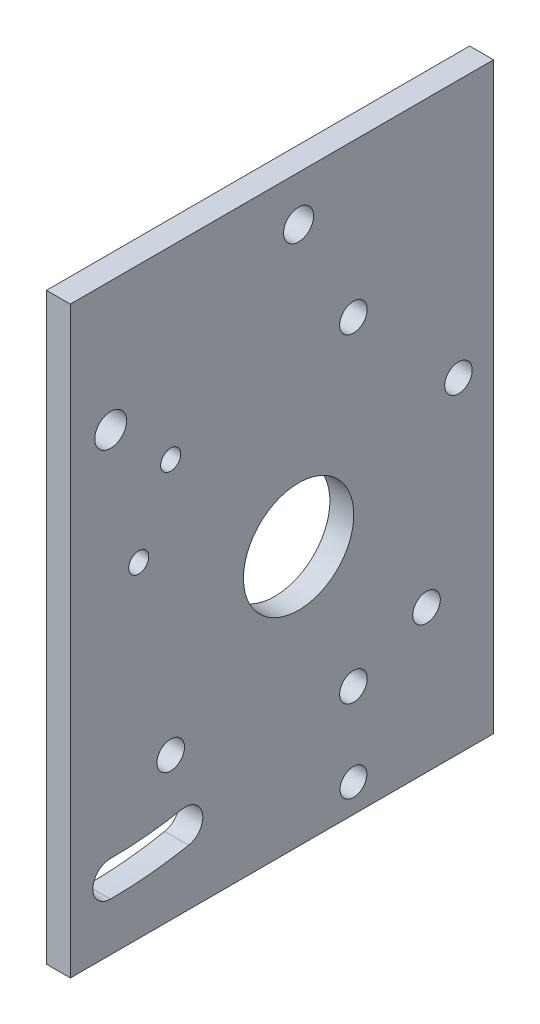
SolidWorks part; units mm, degrees
ref_plane "Front Plane" through (0, 0, 0) normal (0, 0, 1) x (1, 0, 0)
ref_plane "Top Plane" through (0, 0, 0) normal (0, 1, 0) x (1, 0, 0)
ref_plane "Right Plane" through (0, 0, 0) normal (1, 0, 0) x (0, 0, -1)
sketch "Sketch1" plane through (0, 0, 0) normal (1, 0, 0) x (0, 0, -1)
  line L0 (0, 0) -> (-56.4054, 0) construction
  line L1 (38.8644, 64.6163) -> (-45.507, 64.6163)
  line L2 (38.8644, 64.6163) -> (38.8644, -51.7436)
  line L3 (38.8644, -51.7436) -> (-45.507, -51.7436)
  line L4 (-45.507, 64.6163) -> (-45.507, -51.7436)
  line L5 (38.8644, 64.6163) -> (-45.507, -51.7436) construction
  line L6 (38.8644, -51.7436) -> (-45.507, 64.6163) construction
  line L7 (0, 0) -> (0, 42.8926) construction
  circle A0 centre (0, 0) radius 11
  circle A1 centre (-25.5, 27.7621) radius 2
  circle A2 centre (10.9377, 34.1371) radius 2.75
  circle A3 centre (10.9377, -29.6129) radius 2.75
  arc A4 (-37.5233, -38.6139) -> (-22.5927, -37.1728) centre (-37.4682, 38.8861) ccw construction
  arc A5 (-37.5258, -42.1139) -> (-21.9209, -40.6078) centre (-37.4682, 38.8861) ccw
  circle A6 centre (25.5, -23.2379) radius 2.75
  circle A7 centre (31.875, 13.1998) radius 2.75
  circle A8 centre (-31.875, 13.1998) radius 2
  circle A9 centre (-25.5, -23.2379) radius 2.75
  arc A10 (-37.5208, -35.1139) -> (-23.2645, -33.7379) centre (-37.4682, 38.8861) ccw
  arc A11 (-37.5208, -35.1139) -> (-37.5258, -42.1139) centre (-37.5233, -38.6139) ccw
  arc A12 (-21.9209, -40.6078) -> (-23.2645, -33.7379) centre (-22.5927, -37.1728) ccw
  circle A13 centre (10.9377, -46.1121) radius 2.6716
  circle A14 centre (0, 55.6163) radius 3
  circle A15 centre (0, 55.6163) radius 3 construction
  circle A17 centre (-37.4682, 38.8861) radius 3.175
  point P0 (0, 0)
  point P26 (-30.023, -38.2554)
  dimension "D1" = 6.35
  dimension "D3" = 22
  dimension "D4" = 3.5
  dimension "D11" = 4
  dimension "D12" = 4
  dimension "D14" = 77.5
  dimension "D2" = 15
  dimension "D5" = 43.5
  dimension "D6" = 54
  dimension "D7" = 25.5
  dimension "D8" = 27.7621
  dimension "D9" = 31.875
  dimension "D10" = 13.1998
  dimension "D13" = 65
  dimension "D15" = 9
extrude "Boss-Extrude1" add sketch "Sketch1" along normal blind 4.7625
